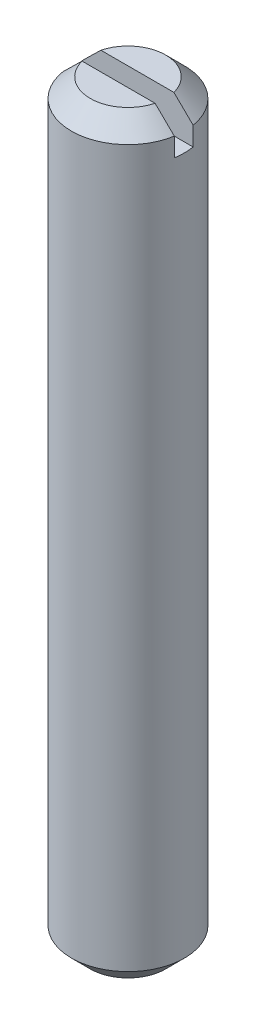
SolidWorks part; units mm, degrees
ref_plane "Plan1" through (0, 0, 0) normal (0, 0, 1) x (1, 0, 0)
ref_plane "Plan2" through (0, 0, 0) normal (0, 1, 0) x (1, 0, 0)
ref_plane "Plan3" through (0, 0, 0) normal (1, 0, 0) x (0, 0, -1)
sketch "Esquisse1" plane through (0, 0, 0) normal (0, 0, 1) x (1, 0, 0)
  line L0 (0, 0) -> (-2, 0)
  line L1 (-2, 0) -> (-3, 1)
  line L2 (-3, 1) -> (-3, 39)
  line L3 (-3, 39) -> (-2, 40)
  line L4 (-2, 40) -> (0, 40)
  line L5 (0, 40) -> (0, 0)
  line L6 (0, 20) -> (0, -5) construction
  dimension "D1" = 4
  dimension "D2" = 6
  dimension "D3" = 1
  dimension "D4" = 40
revolve "Base-Révolution" add sketch "Esquisse1" angle 360 about L6
sketch "Esquisse2" plane through (0, 40, 0) normal (0, 1, 0) x (-1, 0, 0)
  line L0 (-2, 0) -> (2, 0) construction
  line L1 (0, -2.5) -> (0, 3) construction
  line L2 (-3, -0.5) -> (3, -0.5)
  line L3 (-3, -0.5) -> (-3, 0.5)
  line L4 (-3, 0.5) -> (3, 0.5)
  line L5 (3, -0.5) -> (3, 0.5)
  dimension "D1" = 1
  dimension "D2" = 6
extrude "Enlèv. mat.-Extru.1" cut sketch "Esquisse2" against normal blind 2
